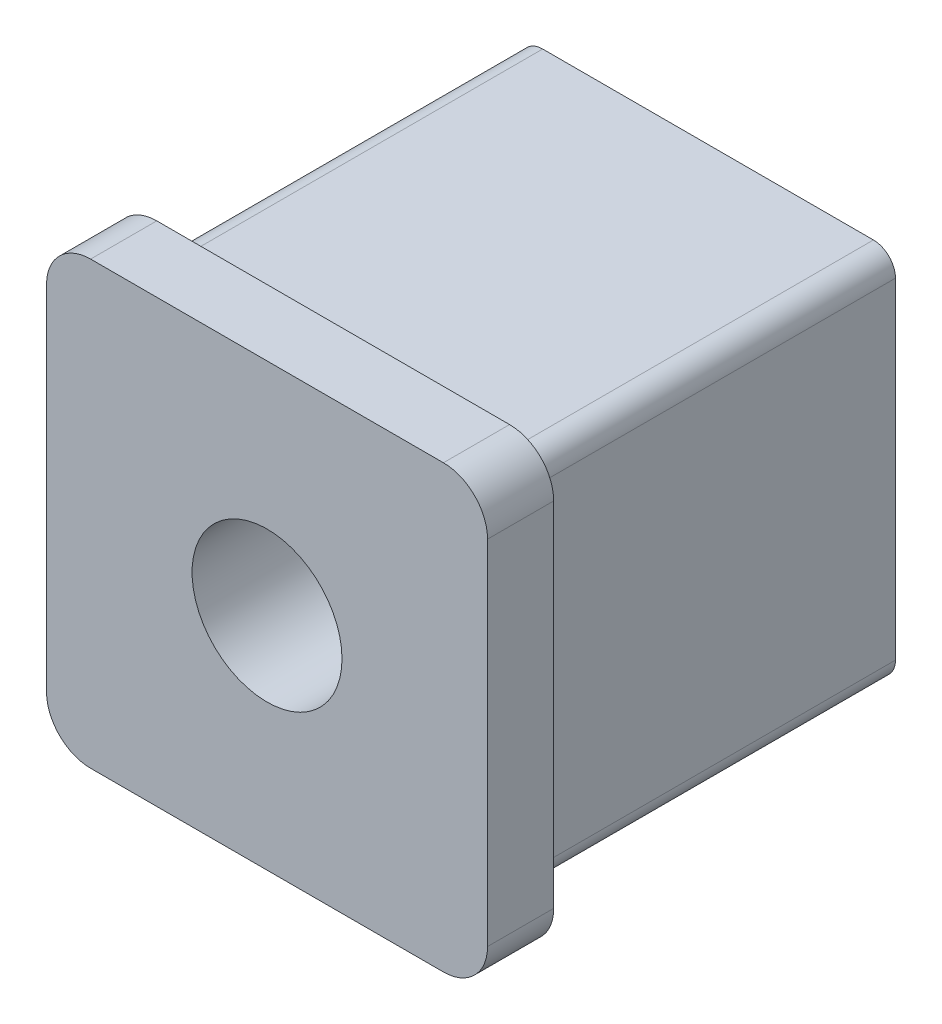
SolidWorks part; units mm, degrees
ref_plane "Plan de face" through (0, 0, 0) normal (0, 0, 1) x (1, 0, 0)
ref_plane "Plan de dessus" through (0, 0, 0) normal (0, 1, 0) x (1, 0, 0)
ref_plane "Plan de droite" through (0, 0, 0) normal (1, 0, 0) x (0, 0, -1)
sketch "Esquisse1" plane through (0, 0, 0) normal (0, 0, 1) x (1, 0, 0)
  line L1 (8, -10) -> (-8, -10)
  line L2 (10, -8) -> (10, 8)
  line L3 (8, 10) -> (-8, 10)
  line L4 (-10, -8) -> (-10, 8)
  arc A0 (-8, 10) -> (-10, 8) centre (-8, 8) ccw
  arc A1 (10, 8) -> (8, 10) centre (8, 8) ccw
  arc A2 (8, -10) -> (10, -8) centre (8, -8) ccw
  arc A3 (-8, -10) -> (-10, -8) centre (-8, -8) cw
  point P6 (-10, 10)
  point P9 (10, 10)
  point P14 (-10, -10)
  dimension "D5" = 2
  dimension "D1" = 20
  dimension "D2" = 20
  dimension "D3" = 10
  dimension "D4" = 10
extrude "Extrusion1" add sketch "Esquisse1" along normal blind 3
sketch "Esquisse2" plane through (0, 0, 0) normal (0, 0, -1) x (-1, 0, 0)
  line L1 (-7.5, 8.5) -> (7.5, 8.5)
  line L2 (-8.5, 7.5) -> (-8.5, -7.5)
  line L3 (-7.5, -8.5) -> (7.5, -8.5)
  line L4 (8.5, 7.5) -> (8.5, -7.5)
  arc A0 (-7.5, 8.5) -> (-8.5, 7.5) centre (-7.5, 7.5) ccw
  arc A1 (7.5, 8.5) -> (8.5, 7.5) centre (7.5, 7.5) cw
  arc A2 (7.5, -8.5) -> (8.5, -7.5) centre (7.5, -7.5) ccw
  arc A3 (-8.5, -7.5) -> (-7.5, -8.5) centre (-7.5, -7.5) ccw
  point P6 (-8.5, 8.5)
  point P9 (8.5, 8.5)
  point P14 (-8.5, -8.5)
  dimension "D5" = 1
  dimension "D1" = 17
  dimension "D2" = 8.5
  dimension "D3" = 17
  dimension "D4" = 8.5
extrude "Extrusion2" add sketch "Esquisse2" along normal blind 17
hole_wizard "Trou taraudé M8x1.251" positions "Esquisse4" profile "Esquisse3" tap size "M8x1.25" standard "ISO"
sketch "Esquisse4" plane through (0, 0, 3) normal (0, 0, 1) x (1, 0, 0)
  point P0 (0, 0)
sketch "Esquisse3" plane through (0, 0, 3) normal (1, 0, 0) x (0, -1, 0)
  line L0 (0, 0) -> (0, 20)
  line L1 (0, 20) -> (3.4, 20)
  line L2 (3.4, 20) -> (3.4, 0)
  line L5 (3.4, 0) -> (0, 0)
  line L11 (0, -6.35) -> (0, 107.95) construction
  dimension "Diamètre du trou pour taraudage jusqu'au prochain" = 6.8
  dimension "Profondeur du trou pour taraudage jusqu'au prochain" = 20
